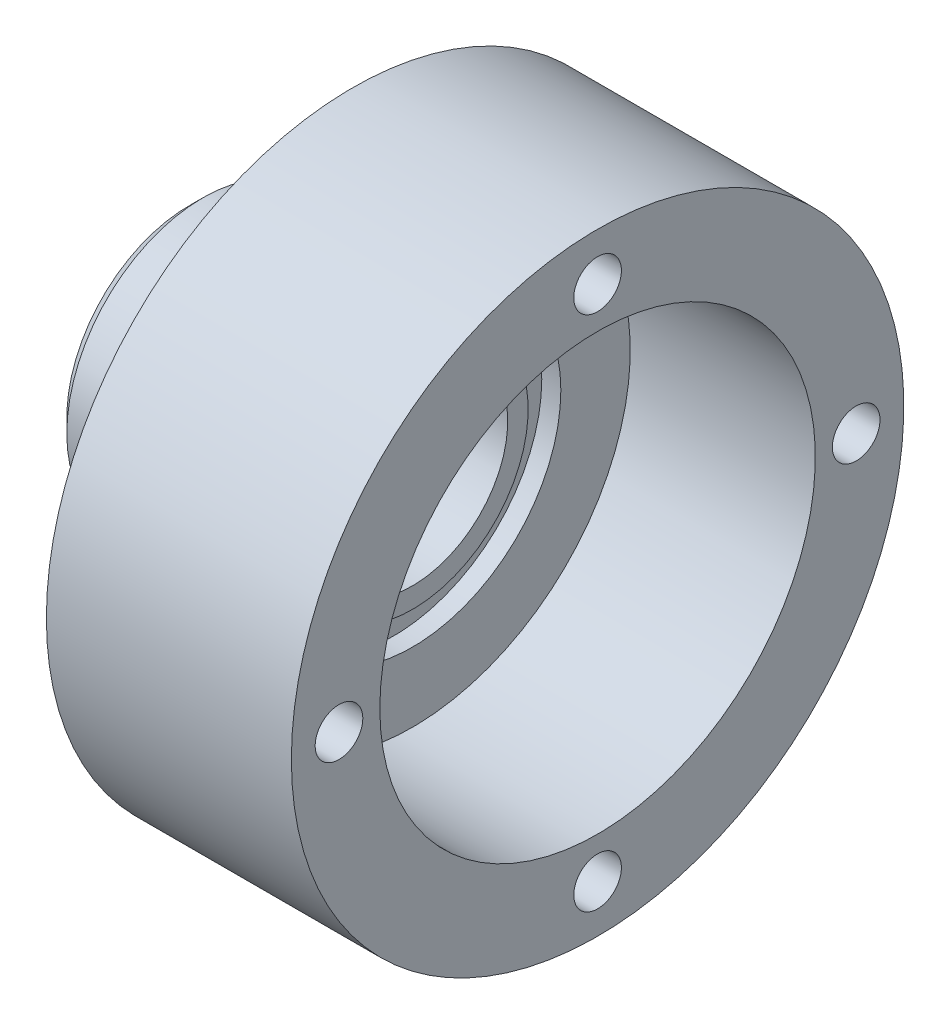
SolidWorks part; units mm, degrees
ref_plane "Plan de face" through (0, 0, 0) normal (0, 0, 1) x (1, 0, 0)
ref_plane "Plan de dessus" through (0, 0, 0) normal (0, 1, 0) x (1, 0, 0)
ref_plane "Plan de droite" through (0, 0, 0) normal (1, 0, 0) x (0, 0, -1)
sketch "Esquisse1" plane through (0, 0, 0) normal (0, 0, 1) x (1, 0, 0)
  line L0 (0, 7) -> (0, 10)
  line L1 (0, 10) -> (10, 10)
  line L2 (10, 10) -> (10, 9)
  line L3 (10, 9) -> (12, 9)
  line L4 (12, 9) -> (12, 11.15)
  line L5 (12, 22.5) -> (30, 22.5)
  line L6 (30, 22.5) -> (30, 16)
  line L8 (-25.5557, 0) -> (44.582, 0) construction
  line L9 (12, 11.15) -> (13.4, 11.15)
  line L10 (13.4, 11.15) -> (13.4, 13.95)
  line L11 (13.4, 13.95) -> (12, 13.95)
  line L12 (12, 13.95) -> (12, 22.5)
  line L13 (16.4, 7) -> (0, 7)
  line L14 (16.4, 7) -> (16.4, 8.5)
  line L15 (16.4, 8.5) -> (15, 8.5)
  line L16 (15, 8.5) -> (15, 10.9)
  line L17 (15, 10.9) -> (16.4, 10.9)
  line L18 (16.4, 10.9) -> (16.4, 16)
  line L19 (16.4, 16) -> (30, 16)
  dimension "D1" = 10
  dimension "D2" = 2
  dimension "D3" = 30
  dimension "D4" = 13.95
  dimension "D5" = 11.15
  dimension "D6" = 10
  dimension "D8" = 9
  dimension "D9" = 8.5
  dimension "D10" = 10.9
  dimension "D11" = 1.4
  dimension "D12" = 1.4
  dimension "D13" = 1.4
  dimension "D14" = 1.4
  dimension "D15" = 16
revolve "Révolution1" add sketch "Esquisse1" angle 360 about L8
sketch "Esquisse5" plane through (30, 0, 0) normal (1, 0, 0) x (0, 0, -1)
  circle A0 centre (0, 19) radius 1.75
  circle A2 centre (19, 0) radius 1.75
  circle A3 centre (0, -19) radius 1.75
  circle A4 centre (-19, 0) radius 1.75
  dimension "D2" = 3.5
  dimension "D3" = 4
extrude "Enlèv. mat.-Extru.2" cut sketch "Esquisse5" against normal blind 10
chamfer "Chanfrein1" distance 1 angle 45 2 edges at (10, 0, 10) (0, 0, 10)
